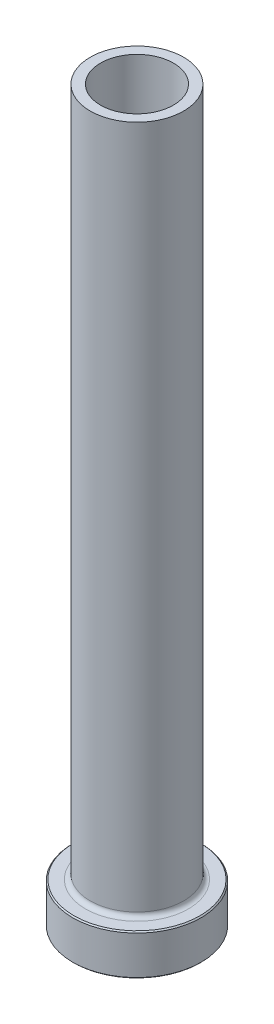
SolidWorks part; units mm, degrees
ref_plane "Front Plane" through (0, 0, 0) normal (0, 0, 1) x (1, 0, 0)
ref_plane "Top Plane" through (0, 0, 0) normal (0, 1, 0) x (1, 0, 0)
ref_plane "Right Plane" through (0, 0, 0) normal (1, 0, 0) x (0, 0, -1)
sketch "Sketch1" plane through (0, 0, 0) normal (0, 0, 1) x (1, 0, 0)
  line L0 (-6.25, 125) -> (-8, 125)
  line L1 (-8, 125) -> (-8, 7)
  line L2 (-8, 7) -> (-11, 7)
  line L3 (-11, 7) -> (-11, 0)
  line L4 (12.1, 0) -> (-12.1, 0) construction
  line L5 (-11, 0) -> (-6.5, 0)
  line L6 (-6.25, 70) -> (-6.25, 125)
  line L7 (0, 92.1877) -> (0, -15.5353) construction
  line L8 (0, -12.1) -> (0, 12.1) construction
  line L9 (-6.25, 70) -> (-6.5, 58)
  line L10 (-6.5, 58) -> (-6.5, 0)
  dimension "D1" = 0.25
  dimension "ID" = 12.5
  dimension "OD" = 16
  dimension "L" = 125
  dimension "H" = 22
  dimension "T" = 7
  dimension "N" = 55
  dimension "D2" = 12
revolve "Revolve1" add sketch "Sketch1" angle 360 about L7
fillet "Fillet1" radius 0.8 1 edges at (0, 7, 8)
chamfer "Chamfer1" distance 0.2 angle 45 2 edges at (0, 7, 11) (0, 0, 11)
chamfer "Chamfer3" distance 0.5 angle 45 1 edges at (0, 0, 6.5)
